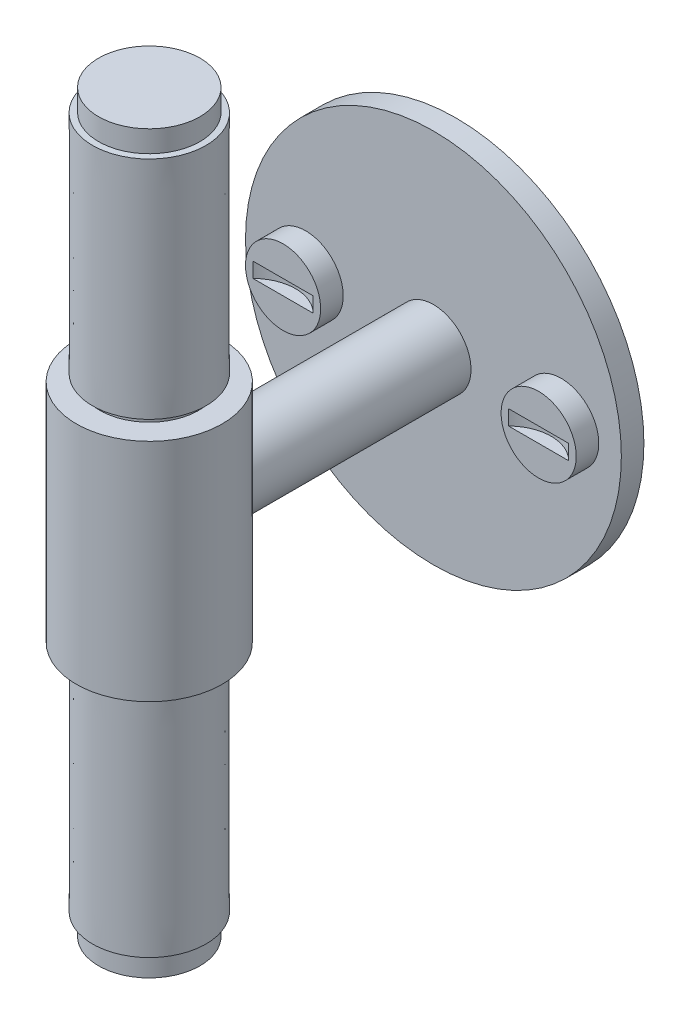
SolidWorks part; units mm, degrees
ref_plane "Front Plane" through (0, 0, 0) normal (0, 0, 1) x (1, 0, 0)
ref_plane "Top Plane" through (0, 0, 0) normal (0, 1, 0) x (1, 0, 0)
ref_plane "Right Plane" through (0, 0, 0) normal (1, 0, 0) x (0, 0, -1)
sketch "Sketch1" plane through (0, 0, 0) normal (1, 0, 0) x (0, 0, -1)
  line L0 (-46.7151, 0) -> (2.1999, 0) construction
  line L1 (-12.8001, 9.7062) -> (17.1999, 9.7062)
  line L2 (-46.7151, 6.75) -> (-46.7151, 0)
  line L3 (51.1148, 0) -> (-46.7151, 0)
  line L4 (51.1148, 6.75) -> (51.1148, 0)
  line L5 (17.1999, 9.7062) -> (17.1999, 6.5917)
  line L6 (17.1999, 6.5917) -> (18.1999, 6.5917)
  line L7 (48.2399, 6.75) -> (48.1999, 7.549)
  line L8 (48.2399, 6.75) -> (51.1148, 6.75)
  line L9 (18.1999, 6.5917) -> (18.1999, 7.55)
  line L10 (18.1999, 7.55) -> (48.1999, 7.549)
  line L13 (-13.8001, 7.55) -> (-43.8001, 7.549)
  line L15 (-13.8001, 6.5917) -> (-13.8001, 7.55)
  line L23 (-43.8402, 6.75) -> (-46.7151, 6.75)
  line L26 (-43.8402, 6.75) -> (-43.8001, 7.549)
  line L27 (-12.8001, 6.5917) -> (-13.8001, 6.5917)
  line L28 (-12.8001, 9.7062) -> (-12.8001, 6.5917)
  dimension "D1" = 6.75
  dimension "D3" = 0.8
  dimension "D4" = 30
  dimension "D5" = 1
revolve "Revolve1" add sketch "Sketch1" angle 360 about L0
move or copy body "Body-Move/Copy2" bodies to move or copy 101 copy no rotation origin (0, 0, -2.1999) rotation axis (0, 1, 0) rotation angle 90
move or copy body "Body-Move/Copy3" bodies to move or copy 103 copy no rotation origin (0, 0, 0) rotation axis (0, 0, 1) rotation angle 90
sketch "Sketch2" plane through (0, 0, 0) normal (0, 0, 1) x (1, 0, 0)
  circle A0 centre (0, 0) radius 5
extrude "Boss-Extrude2" add sketch "Sketch2" against normal blind 40
sketch "Sketch3" plane through (0, 0, -40) normal (0, 0, -1) x (-1, 0, 0)
  circle A0 centre (0, 0) radius 25
extrude "Boss-Extrude3" add sketch "Sketch3" along normal blind 3
sketch "Sketch4" plane through (0, 0, -40) normal (0, 0, 1) x (1, 0, 0)
  line L0 (0, 0) -> (17, 0) construction
  line L1 (22, 0) -> (25, 0) construction
  circle A0 centre (17, 0) radius 5
  circle A1 centre (0, 0) radius 25 construction
  dimension "D1" = 17
  dimension "D2" = 10
extrude "Boss-Extrude4" add sketch "Sketch4" along normal blind 3
sketch "Sketch7" plane through (0, 0, 0) normal (0, 1, 0) x (1, 0, 0)
  line L0 (12, 37) -> (13, 37) construction
  line L1 (12, 37) -> (22, 37) construction
  line L3 (22, 37) -> (21, 37) construction
  line L5 (13, 37) -> (13, 35.9481)
  line L6 (13, 35.9481) -> (21, 35.9481)
  line L7 (21, 37) -> (21, 35.9481)
  arc A0 (13, 37) -> (21, 37) centre (17, 33) cw
extrude "Cut-Extrude1" cut sketch "Sketch7" against normal mid plane 2
mirror "Mirror2" about plane through (0, 0, 0) normal (1, 0, 0) of "Cut-Extrude1", "Boss-Extrude4"
